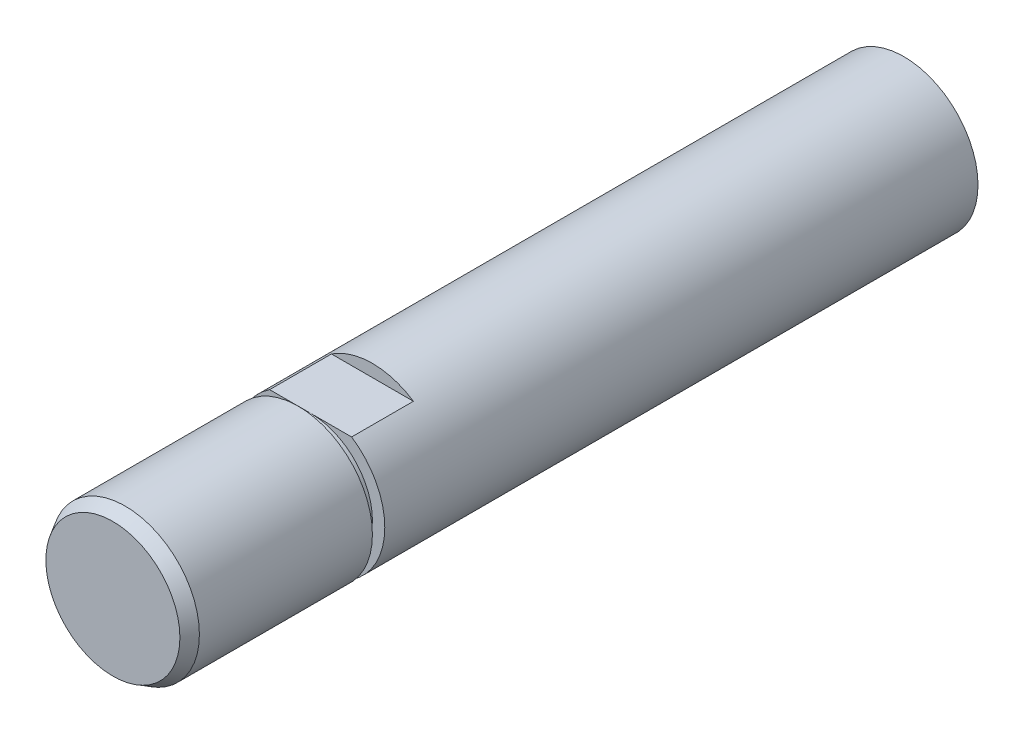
SolidWorks part; units mm, degrees
ref_plane "Front Plane" through (0, 0, 0) normal (0, 0, 1) x (1, 0, 0)
ref_plane "Top Plane" through (0, 0, 0) normal (0, 1, 0) x (1, 0, 0)
ref_plane "Right Plane" through (0, 0, 0) normal (1, 0, 0) x (0, 0, -1)
ref_plane "Plane1" through (0, 0, 8) normal (0, 0, 1) x (1, 0, 0)
sketch "Sketch1" plane through (0, 0, 0) normal (0, 0, 1) x (1, 0, 0)
  circle A0 centre (0, 0) radius 6
  dimension "D1" = 12
extrude "Extrude1" add sketch "Sketch1" against normal blind 40
sketch "Sketch2" plane through (0, 0, 0) normal (0, 0, 1) x (1, 0, 0)
  circle A0 centre (0, 0) radius 6
  dimension "D1" = 12
extrude "Extrude2" add sketch "Sketch2" along normal blind 8
sketch "Sketch3" plane through (0, 0, 8) normal (0, 0, 1) x (1, 0, 0)
  circle A0 centre (0, 0) radius 6
  dimension "D1" = 12
extrude "Extrude3" add sketch "Sketch3" along normal blind 16
chamfer "Chamfer2" distance 1 angle 30 1 edges at (6, 0, 24)
sketch "Sketch5" plane through (0, 0, 8) normal (0, 0, 1) x (1, 0, 0)
  circle A0 centre (0, 0) radius 5
  circle A1 centre (0, 0) radius 6.5
  dimension "D1" = 10
  dimension "D2" = 13
extrude "Cut-Extrude1" cut sketch "Sketch5" along normal blind 1
sketch "Sketch6" plane through (0, 0, 0) normal (1, 0, 0) x (0, 0, -1)
  line L0 (-8, 6) -> (-8, -6) construction
  line L1 (-8, 10.3815) -> (-3, 10.3815)
  line L2 (-8, 10.3815) -> (-8, 5)
  line L3 (-8, 5) -> (-3, 5)
  line L4 (-3, 10.3815) -> (-3, 5)
  line L5 (-8, -5) -> (-3, -5)
  line L6 (-8, -5) -> (-8, -11.2121)
  line L7 (-8, -11.2121) -> (-3, -11.2121)
  line L8 (-3, -5) -> (-3, -11.2121)
  line L9 (-8, 5) -> (-8, -5) construction
  line L10 (40, 0) -> (-8, 0) construction
  dimension "D1" = 5
  dimension "D2" = 10
  dimension "D3" = 5
extrude "Cut-Extrude2" cut sketch "Sketch6" against normal mid plane 21
